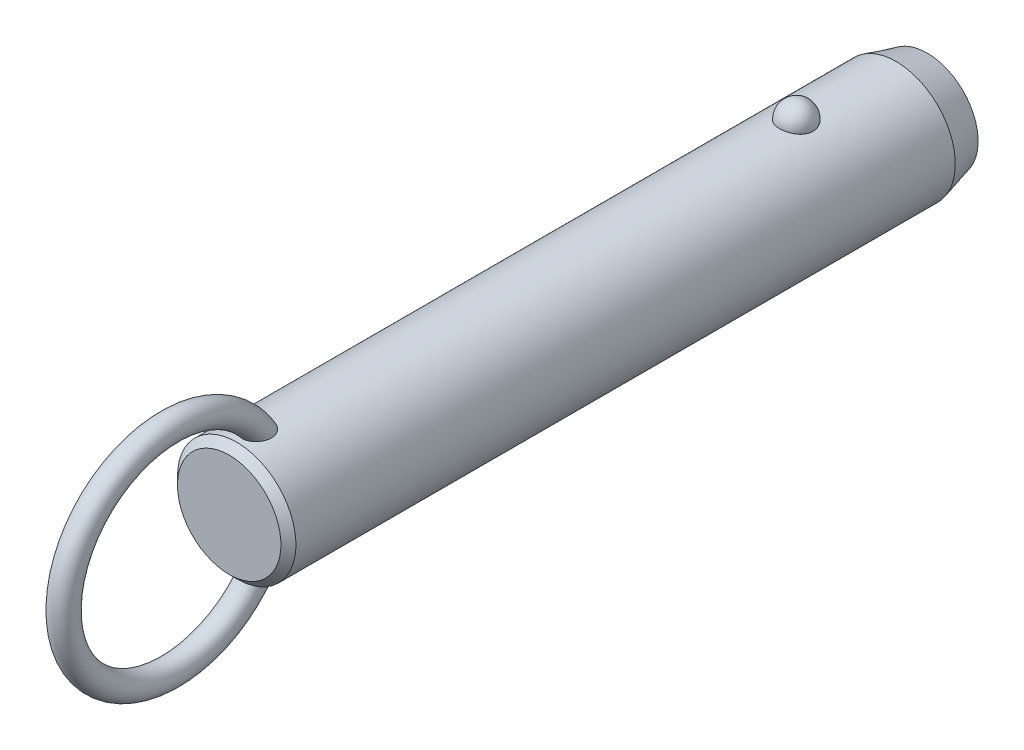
SolidWorks part; units mm, degrees
ref_plane "Front Plane" through (0, 0, 0) normal (0, 0, 1) x (1, 0, 0)
ref_plane "Top Plane" through (0, 0, 0) normal (0, 1, 0) x (1, 0, 0)
ref_plane "Right Plane" through (0, 0, 0) normal (1, 0, 0) x (0, 0, -1)
sketch "Sketch2" plane through (0, 0, 0) normal (0, 0, 1) x (1, 0, 0)
  circle A0 centre (0, 0) radius 9.5
  point P3 (0, 9.5)
  dimension "D1" = 19
extrude "Boss-Extrude1" add sketch "Sketch2" along normal blind 78.8
sketch "Sketch3" plane through (0, 0, 0) normal (0, 0, -1) x (-1, 0, 0)
  circle A0 centre (0, 0) radius 9.5
  dimension "D1" = 19
extrude "Boss-Extrude2" add sketch "Sketch3" along normal blind 23.7
chamfer "Chamfer1" distance 5 angle 15 1 edges at (-9.5, 0, -23.7)
sketch "Sketch12" plane through (0, 0, 0) normal (1, 0, 0) x (0, 0, -1)
  line L0 (-78.8, 9.5) -> (-78.8, -9.5) construction
  point P0 (-78.8, 0)
sketch "Sketch13" plane through (0, 0, 0) normal (1, 0, 0) x (0, 0, -1)
  circle A0 centre (-97.85, 0) radius 19.05
  point P2 (-78.8, 0)
  dimension "D1" = 38.1
sketch "Sketch14" plane through (0, 0, 0) normal (0, 1, 0) x (1, 0, 0)
  circle A0 centre (0, -80.8) radius 2
  point P2 (0, -78.8)
  dimension "D1" = 4
sweep "Sweep1" add profiles "Sketch14" path "Sketch13"
sketch "Sketch15" plane through (0, 0, 78.8) normal (0, 0, 1) x (1, 0, 0)
  circle A0 centre (0, 0) radius 9.5
  dimension "D1" = 19
extrude "Boss-Extrude3" add sketch "Sketch15" along normal blind 9.52
chamfer "Chamfer2" distance 1.2 angle 45 1 edges at (9.5, 0, 88.32)
sketch "Sketch18" plane through (0, 0, 0) normal (1, 0, 0) x (0, 0, -1)
  line L0 (18.7, 9.5) -> (-81.3378, 9.5) construction
  line L1 (2.7, 12.2) -> (2.7, 6.8)
  line L2 (-81.3378, -9.5) -> (18.7, -9.5) construction
  arc A0 (2.7, 12.2) -> (2.7, 6.8) centre (2.7, 9.5) ccw
  point P4 (0, 9.5)
  dimension "D1" = 21.7
revolve "Revolve1" add sketch "Sketch18" angle 360 about L1
